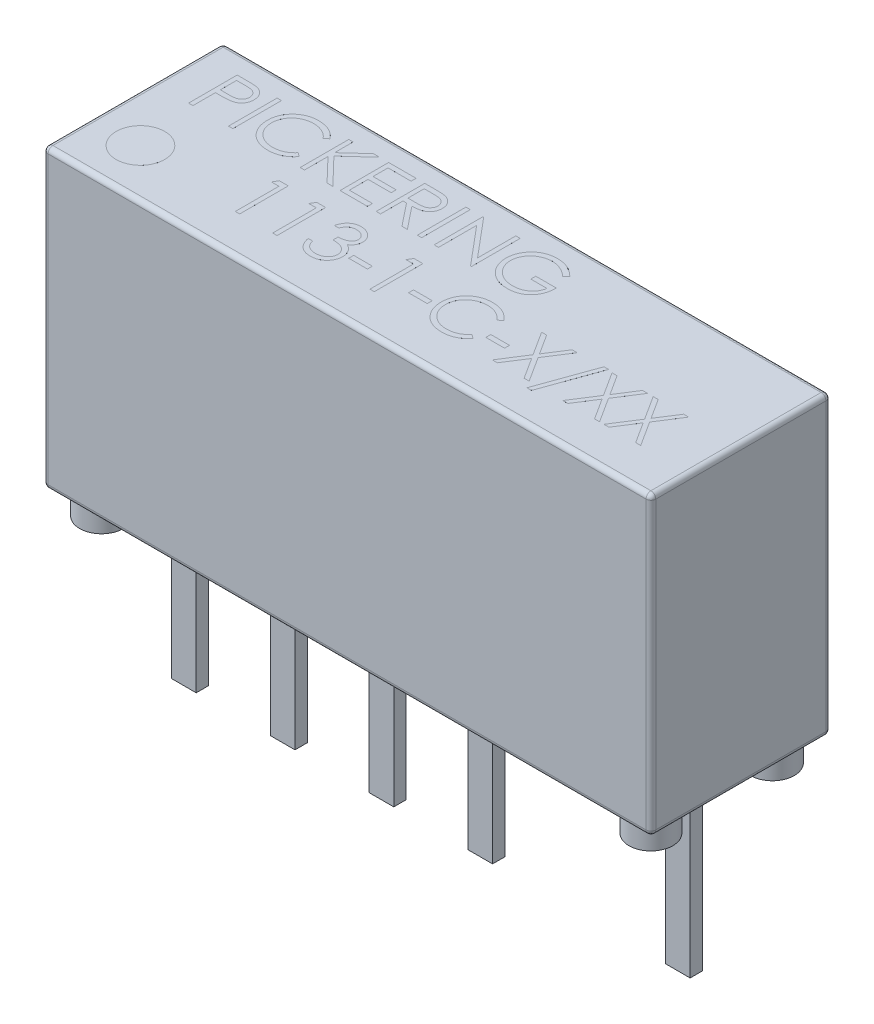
SolidWorks part; units mm, degrees
ref_plane "Front Plane" through (0, 0, 0) normal (0, 0, 1) x (1, 0, 0)
ref_plane "Top Plane" through (0, 0, 0) normal (0, 1, 0) x (1, 0, 0)
ref_plane "Right Plane" through (0, 0, 0) normal (1, 0, 0) x (0, 0, -1)
sketch "Sketch1" plane through (0, 0, 0) normal (0, 1, 0) x (1, 0, 0)
  line L1 (6.25, -1.85) -> (-6.25, -1.85)
  line L2 (6.25, -1.85) -> (6.25, 1.85)
  line L3 (6.25, 1.85) -> (-6.25, 1.85)
  line L4 (-6.25, -1.85) -> (-6.25, 1.85)
  line L5 (6.25, -1.85) -> (-6.25, 1.85) construction
  line L6 (6.25, 1.85) -> (-6.25, -1.85) construction
  point P0 (0, 0)
  dimension "D1" = 12.5
  dimension "D2" = 3.7
extrude "Main Body" add sketch "Sketch1" along normal blind 6.092
sketch "Sketch2" plane through (0, 0, 0) normal (0, -1, 0) x (1, 0, 0)
  line L0 (-6.25, 1.85) -> (6.25, 1.85) construction
  line L1 (-6.25, -1.85) -> (-6.25, 1.85) construction
  line L2 (6.25, -1.85) -> (-6.25, -1.85) construction
  line L3 (6.25, 1.85) -> (6.25, -1.85) construction
  circle A0 centre (-5.65, 1.25) radius 0.45
  circle A1 centre (-5.65, -1.25) radius 0.45
  circle A2 centre (5.65, -1.25) radius 0.45
  circle A3 centre (5.65, 1.25) radius 0.45
  dimension "D1" = 0.9
  dimension "D4" = 0.9
  dimension "D6" = 0.9
  dimension "D8" = 0.9
  dimension "D2" = 0.6
  dimension "D3" = 0.6
  dimension "D5" = 0.6
  dimension "D7" = 0.6
extrude "Feet" add sketch "Sketch2" along normal blind 0.508
sketch "Sketch3" plane through (0, 0, 0) normal (0, -1, 0) x (1, 0, 0)
  line L2 (-2.794, -0.127) -> (-2.794, 0.127)
  line L3 (-2.794, 0.127) -> (-3.302, 0.127)
  line L4 (-3.302, -0.127) -> (-3.302, 0.127)
  line L5 (-2.794, -0.127) -> (-3.302, 0.127) construction
  line L6 (-2.794, 0.127) -> (-3.302, -0.127) construction
  line L7 (-0.762, -0.127) -> (-1.27, -0.127)
  line L8 (-0.762, -0.127) -> (-0.762, 0.127)
  line L9 (-0.762, 0.127) -> (-1.27, 0.127)
  line L10 (-1.27, -0.127) -> (-1.27, 0.127)
  line L11 (-0.762, -0.127) -> (-1.27, 0.127) construction
  line L12 (-0.762, 0.127) -> (-1.27, -0.127) construction
  line L13 (1.27, -0.127) -> (0.762, -0.127)
  line L14 (1.27, -0.127) -> (1.27, 0.127)
  line L15 (1.27, 0.127) -> (0.762, 0.127)
  line L16 (0.762, -0.127) -> (0.762, 0.127)
  line L17 (1.27, -0.127) -> (0.762, 0.127) construction
  line L18 (1.27, 0.127) -> (0.762, -0.127) construction
  line L26 (-6.25, -1.85) -> (-6.25, 1.85) construction
  line L27 (-5.334, -0.127) -> (-4.826, -0.127)
  line L28 (-5.334, -0.127) -> (-5.334, 0.127)
  line L29 (-5.334, 0.127) -> (-4.826, 0.127)
  line L30 (-4.826, -0.127) -> (-4.826, 0.127)
  line L31 (-5.334, -0.127) -> (-4.826, 0.127) construction
  line L32 (-5.334, 0.127) -> (-4.826, -0.127) construction
  line L33 (4.826, -0.1297) -> (5.334, -0.127)
  line L34 (4.826, -0.1297) -> (4.826, 0.127)
  line L35 (4.826, 0.127) -> (5.334, 0.127)
  line L36 (5.334, -0.127) -> (5.334, 0.127)
  line L37 (4.826, -0.1297) -> (5.334, 0.127) construction
  line L38 (4.826, 0.127) -> (5.334, -0.127) construction
  point P0 (-3.048, 0)
  point P5 (-1.016, 0)
  point P10 (1.016, 0)
  point P23 (-5.08, 0)
  point P28 (5.08, 0)
  dimension "D1" = 0.508
  dimension "D2" = 0.254
  dimension "D3" = 0.508
  dimension "D4" = 0.254
  dimension "D5" = 0.508
  dimension "D6" = 0.254
  dimension "D7" = 4.064
  dimension "D9" = 0.508
  dimension "D10" = 0.508
  dimension "D11" = 2.032
  dimension "D12" = 2.032
  dimension "D13" = 2.032
  dimension "D16" = 1.17
extrude "Pins" add sketch "Sketch3" along normal blind 3.808
sketch "Sketch4"
  dimension "D3" = 1
  dimension "D1" = 1.45
  dimension "D2" = 1.45
  dimension "D4" = 1
  dimension "D5" = 1
extrude "Lettering" add sketch "Sketch4" along normal blind 0.0001
fillet "Fillet1" radius 0.1 12 edges at (6.25, 6.092, 0) (6.25, 0, 0) (6.25, 3.046, -1.85) (0, 6.092, -1.85) (0, 0, -1.85) (-6.25, 3.046, -1.85) (-6.25, 6.092, 0) (-6.25, 0, 0) (-6.25, 3.046, 1.85) (0, 6.092, 1.85) (6.25, 3.046, 1.85) (0, 0, 1.85)
